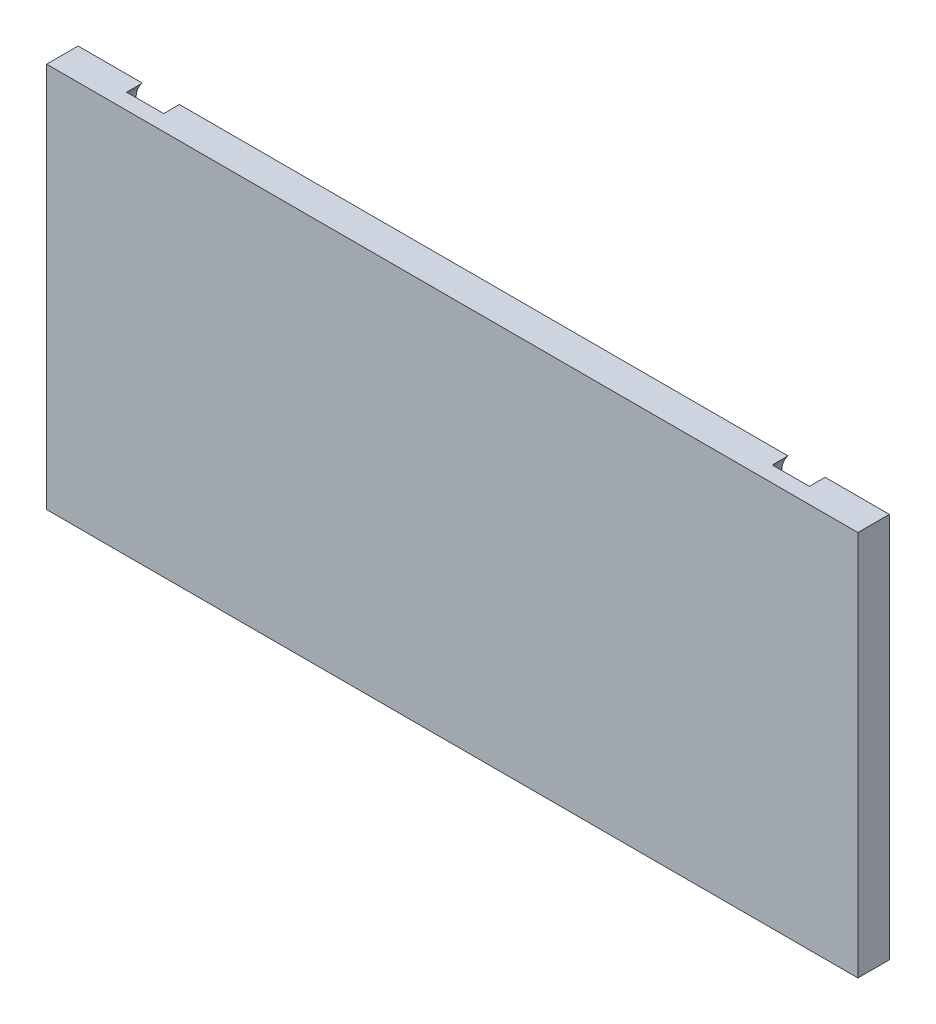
SolidWorks part; units mm, degrees
ref_plane "Plan de face" through (0, 0, 0) normal (0, 0, 1) x (1, 0, 0)
ref_plane "Plan de dessus" through (0, 0, 0) normal (0, 1, 0) x (1, 0, 0)
ref_plane "Plan de droite" through (0, 0, 0) normal (1, 0, 0) x (0, 0, -1)
sketch "Esquisse1" plane through (0, 0, 0) normal (0, 0, 1) x (1, 0, 0)
  line L1 (-245, -116.5) -> (245, -116.5)
  line L2 (-245, -116.5) -> (-245, 116.5)
  line L3 (-245, 116.5) -> (245, 116.5)
  line L4 (245, -116.5) -> (245, 116.5)
  line L5 (-245, -116.5) -> (245, 116.5) construction
  line L6 (-245, 116.5) -> (245, -116.5) construction
  point P0 (0, 0)
  dimension "D1" = 233
  dimension "D2" = 490
extrude "Boss.-Extru.1" add sketch "Esquisse1" along normal blind 19
sketch "Esquisse2" plane through (0, 0, 0) normal (0, 0, -1) x (-1, 0, 0)
  line L0 (245, 116.5) -> (245, -116.5) construction
  line L1 (-245, 116.5) -> (245, 116.5) construction
  circle A0 centre (-195, -106.5) radius 15
  circle A1 centre (195, -106.5) radius 15
  circle A2 centre (195, 106.5) radius 15
  circle A3 centre (-195, 106.5) radius 15
  dimension "D1" = 30
  dimension "D2" = 50
  dimension "D3" = 390
  dimension "D4" = 10
  dimension "D5" = 213
extrude "Enlèv. mat.-Extru.1" cut sketch "Esquisse2" against normal blind 9.5
